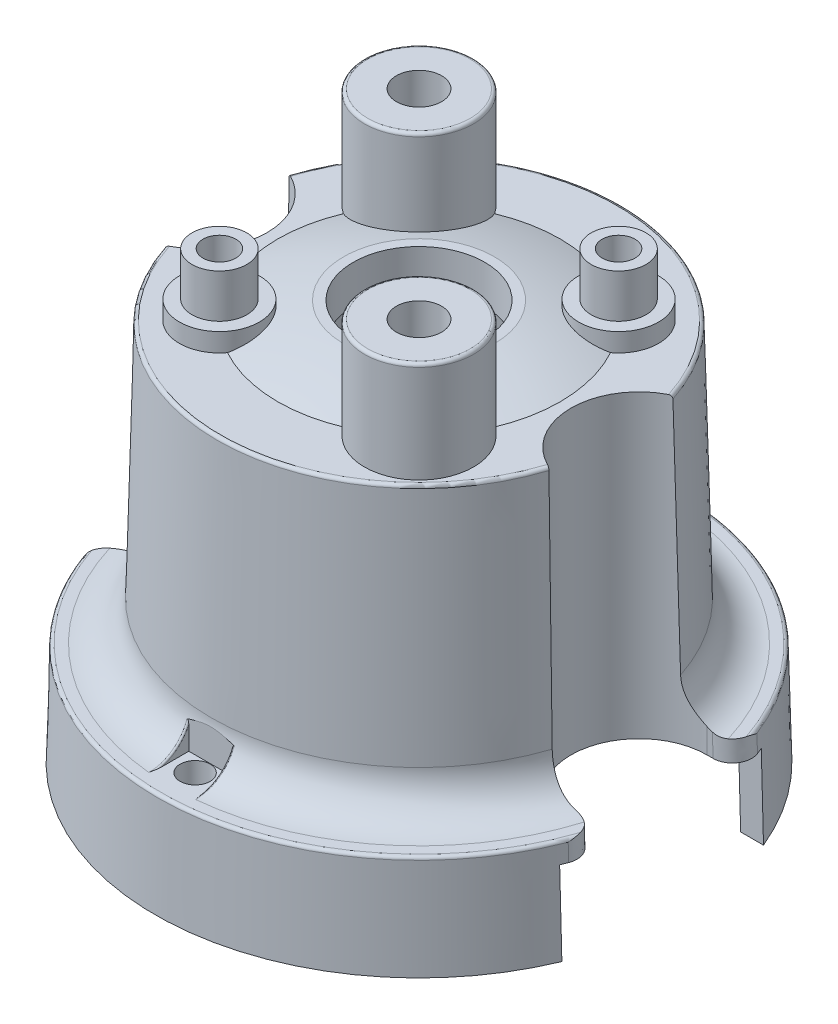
SolidWorks part; units mm, degrees
ref_plane "Front Plane" through (0, 0, 0) normal (0, 0, 1) x (1, 0, 0)
ref_plane "Top Plane" through (0, 0, 0) normal (0, 1, 0) x (1, 0, 0)
ref_plane "Right Plane" through (0, 0, 0) normal (1, 0, 0) x (0, 0, -1)
sketch "Sketch1" plane through (0, 0, 0) normal (0, 0, 1) x (1, 0, 0)
  line L0 (0, 0) -> (0, -78.6325) construction
  line L1 (20.7645, -38.1) -> (0, -38.1)
  line L2 (0, -6.0325) -> (-33.6738, -6.0325) construction
  line L3 (11.1125, -7.9375) -> (15.875, -7.9375)
  line L4 (15.875, -7.9375) -> (16.3447, -26.8757)
  line L5 (0, -38.1) -> (0, -6.0325)
  line L6 (20.5629, -29.972) -> (20.7645, -38.1)
  line L7 (20.5629, -29.972) -> (19.5187, -29.972)
  arc A0 (0, -6.0325) -> (11.1125, -7.9375) centre (0, -39.3965) cw
  arc A1 (19.5187, -29.972) -> (16.3447, -26.8757) centre (19.5187, -26.797) cw
  dimension "D1" = 3.175
  dimension "D2" = 4.1402
  dimension "D3" = 30.1625
  dimension "D4" = 22.225
  dimension "D5" = 31.75
  dimension "D6" = 1.905
  dimension "D7" = 8.128
  dimension "D8" = 41.529
  dimension "D9" = 38.1
revolve "Revolve1" add sketch "Sketch1" angle 360 about L0
sketch "Sketch2" plane through (0, -38.1, 0) normal (0, -1, 0) x (1, 0, 0)
  line L0 (0, 0) -> (17.3212, 0) construction
  line L1 (0, 0) -> (0, 12.9709) construction
  line L2 (-17.3212, 5.3578) -> (-30.4763, 5.3578)
  line L3 (17.3212, 5.3578) -> (30.4763, 5.3578)
  line L4 (17.3212, -5.3578) -> (30.4763, -5.3578)
  line L5 (-17.3212, -5.3578) -> (-30.4763, -5.3578)
  line L6 (-30.4763, 5.3578) -> (-30.4763, -5.3578)
  line L7 (30.4763, 5.3578) -> (30.4763, -5.3578)
  arc A0 (17.3212, 5.3578) -> (17.3212, -5.3578) centre (17.3212, 0) ccw
  arc A1 (-17.3212, 5.3578) -> (-17.3212, -5.3578) centre (-17.3212, 0) cw
  dimension "D1" = 10.7156
  dimension "D2" = 23.9268
  dimension "D3" = 60.9525
extrude "Cut-Extrude1" cut sketch "Sketch2" against normal through all
fillet "Fillet1" radius 0.254 4 edges at (0, -7.9375, 15.875) (0, -7.9375, -15.875) (0, -29.972, -20.5629) (0, -29.972, 20.5629)
shell "Shell1" thickness 1.651
sketch "Sketch3" plane through (0, 0, 0) normal (1, 0, 0) x (0, 0, -1)
  line L2 (14.6942, -26.9166) -> (14.2644, -9.5885) construction
  line L3 (14.8101, -31.5896) -> (14.6942, -26.9166)
  line L5 (18.9515, -31.5896) -> (14.8101, -31.5896)
  arc A0 (14.6942, -26.9166) -> (18.9515, -31.5896) centre (19.5187, -26.797) ccw construction
  arc A1 (14.6942, -26.9166) -> (18.9515, -31.5896) centre (19.5187, -26.797) ccw
revolve "Revolve2" add sketch "Sketch3" angle 360
sketch "Sketch4" plane through (0, -38.1, 0) normal (0, -1, 0) x (1, 0, 0)
  line L0 (-17.3212, 5.3578) -> (-20.0614, 5.3578) construction
  line L1 (-17.3212, -5.3578) -> (-20.0614, -5.3578) construction
  line L2 (17.3212, 5.3578) -> (20.0614, 5.3578) construction
  line L3 (17.3212, -5.3578) -> (20.0614, -5.3578) construction
  line L4 (-17.3212, 5.3578) -> (-20.0614, 5.3578)
  line L5 (-17.3212, -5.3578) -> (-20.0614, -5.3578)
  line L6 (17.3212, 5.3578) -> (20.0614, 5.3578)
  line L7 (17.3212, -5.3578) -> (20.0614, -5.3578)
  line L8 (-20.0614, 5.3578) -> (-20.0614, -5.3578)
  line L9 (20.0614, 5.3578) -> (20.0614, -5.3578)
  arc A0 (-17.3212, -5.3578) -> (-17.3212, 5.3578) centre (-17.3212, 0) ccw construction
  arc A1 (17.3212, 5.3578) -> (17.3212, -5.3578) centre (17.3212, 0) ccw construction
  arc A2 (-17.3212, -5.3578) -> (-17.3212, 5.3578) centre (-17.3212, 0) ccw
  arc A3 (17.3212, 5.3578) -> (17.3212, -5.3578) centre (17.3212, 0) ccw
extrude "Cut-Extrude2" cut sketch "Sketch4" against normal through all
sketch "Sketch5" plane through (0, 0, 0) normal (1, 0, 0) x (0, 0, -1)
  line L0 (-10.8258, -9.5885) -> (0, -9.5885)
  line L1 (0, -26.8757) -> (0, -8.1852) construction
  line L2 (-10.8258, -9.5885) -> (-10.8258, -8.6389)
  line L3 (-10.8258, -8.6389) -> (0, -6.905)
  line L4 (0, -13.2827) -> (0, 5.6104) construction
  line L5 (0, -6.905) -> (0, -9.5885)
  dimension "D1" = 0.9496
  dimension "D2" = 2.6835
revolve "Revolve3" add sketch "Sketch5" angle 360 about axis through (0, -26.8757, 0) along (0, -1, 0)
sketch "Sketch6" plane through (0, -9.5885, 0) normal (0, -1, 0) x (1, 0, 0)
  circle A0 centre (0, 0) radius 5.1816
  dimension "D1" = 10.3632
extrude "Cut-Extrude3" cut sketch "Sketch6" against normal through all
sketch "Sketch7" plane through (0, -9.5885, 0) normal (0, -1, 0) x (1, 0, 0)
  line L0 (0, 0) -> (26.8449, 0) construction
  line L1 (0, 0) -> (21.4445, 21.4445) construction
  line L2 (0, 0) -> (-19.5426, 19.5426) construction
  circle A0 centre (7.8577, 7.8577) radius 4.2926
  circle A1 centre (-7.8577, -7.8577) radius 4.2926
  dimension "D2" = 22.225
  dimension "D3" = 8.5852
  dimension "D1" = 45
extrude "Boss-Extrude1" add sketch "Sketch7" against normal up to surface (9.5885 mm away)
fillet "Fillet2" radius 0.254 2 edges at (7.8577, 0, 12.1503) (-7.8577, 0, -3.5651)
sketch "Sketch8" plane through (0, 0, 0) normal (0, 1, 0) x (1, 0, 0)
  circle A0 centre (-7.8577, 7.8577) radius 1.778
  circle A1 centre (7.8577, -7.8577) radius 1.778
  dimension "D1" = 3.556
extrude "Cut-Extrude4" cut sketch "Sketch8" against normal through all
sketch "Sketch9" plane through (0, -38.1, 0) normal (0, -1, 0) x (1, 0, 0)
  line L0 (0, 0) -> (0, 30.6603) construction
  line L1 (0, 0) -> (43.4145, 0) construction
  circle A0 centre (0, 17.6276) radius 2.8575
  dimension "D1" = 5.715
  dimension "D2" = 35.2552
extrude "Boss-Extrude2" add sketch "Sketch9" against normal up to body
sketch "Sketch10" plane through (0, -38.1, 0) normal (0, -1, 0) x (1, 0, 0)
  circle A0 centre (0, 17.6276) radius 1.1811
  dimension "D1" = 2.3622
extrude "Cut-Extrude5" cut sketch "Sketch10" against normal through all
sketch "Sketch11" plane through (0, -29.972, 0) normal (0, 1, 0) x (1, 0, 0)
  line L0 (0, -17.6276) -> (0, -23.9071) construction
  line L2 (-1.7145, -22.0318) -> (1.7145, -22.0318)
  line L3 (-1.7145, -22.0318) -> (-1.7145, -16.4084)
  line L4 (-1.7145, -16.4084) -> (1.7145, -16.4084)
  line L5 (1.7145, -22.0318) -> (1.7145, -16.4084)
  line L6 (-1.7145, -22.0318) -> (1.7145, -16.4084) construction
  line L7 (-1.7145, -16.4084) -> (1.7145, -22.0318) construction
  circle A0 centre (0, -17.6276) radius 1.1811 construction
  point P4 (0, -19.2201)
  dimension "D1" = 3.429
  dimension "D2" = 1.2192
  dimension "D3" = 5.6234
extrude "Cut-Extrude6" cut sketch "Sketch11" along normal blind 7.62
fillet "Fillet3" radius 0.127 2 edges at (1.7145, -23.9681, 20.89) (-1.7145, -24.3353, 21.4554)
mirror "Mirror1" about plane through (0, 0, 0) normal (0, 0, 1) of "Fillet3", "Boss-Extrude2", "Cut-Extrude5", "Cut-Extrude6"
ref_plane "Plane1" through (0, -6.4373, 0) normal (0, -1, 0) x (-1, 0, 0)
sketch "Sketch12" plane through (0, -6.4373, 0) normal (0, -1, 0) x (-1, 0, 0)
  circle A0 centre (0, 0) radius 5.1816 construction
  circle A1 centre (0, 0) radius 5.1816
  circle A2 centre (0, 0) radius 6.1976
  dimension "D1" = 1.016
extrude "Cut-Extrude7" cut sketch "Sketch12" along normal blind 0.127
sketch "Sketch13" plane through (0, -9.5885, 0) normal (0, -1, 0) x (1, 0, 0)
  line L0 (0, 0) -> (-19.8017, 0) construction
  line L1 (0, 0) -> (-12.0919, 12.0919) construction
  line L2 (0, 0) -> (4.7925, 4.7925) construction
  circle A0 centre (-7.8577, 7.8577) radius 2.159
  circle A1 centre (7.8577, -7.8577) radius 2.159
  dimension "D2" = 22.225
  dimension "D3" = 4.318
  dimension "D1" = 45
extrude "Boss-Extrude3" add sketch "Sketch13" against normal offset from surface (6.5405 mm away) 3.048
sketch "Sketch14" plane through (0, -9.5885, 0) normal (0, -1, 0) x (1, 0, 0)
  line L0 (0, 0) -> (-7.8577, 7.8577) construction
  line L1 (0, 0) -> (5.2539, 5.2539) construction
  circle A0 centre (-7.8577, 7.8577) radius 2.159 construction
  circle A1 centre (-7.8577, 7.8577) radius 2.159 construction
  circle A2 centre (-7.8577, 7.8577) radius 3.1496
  circle A3 centre (7.8577, -7.8577) radius 3.1496
  dimension "D1" = 6.2992
extrude "Boss-Extrude4" add sketch "Sketch14" against normal offset from surface (3.1115 mm away) 3.429
sketch "Sketch15" plane through (0, -9.5885, 0) normal (0, -1, 0) x (1, 0, 0)
  line L0 (-7.8577, 7.8577) -> (0, 0) construction
  line L1 (0, 0) -> (4.5197, 4.5197) construction
  circle A0 centre (-7.8577, 7.8577) radius 2.159 construction
  circle A1 centre (-7.8577, 7.8577) radius 2.159
  circle A2 centre (7.8577, -7.8577) radius 2.159
extrude "Boss-Extrude5" add sketch "Sketch15" along normal blind 2.667
sketch "Sketch16" plane through (0, -12.2555, 0) normal (0, -1, 0) x (1, 0, 0)
  line L0 (-7.8577, 7.8577) -> (0, 0) construction
  line L1 (0, 0) -> (4.3679, 4.3679) construction
  circle A0 centre (-7.8577, 7.8577) radius 1.2954
  circle A1 centre (7.8577, -7.8577) radius 1.2954
  dimension "D1" = 2.5908
extrude "Cut-Extrude8" cut sketch "Sketch16" against normal through all
chamfer "Chamfer1" distance 1.524 angle 45 2 edges at (-6.0797, -9.5885, -7.8577) (9.6357, -9.5885, 7.8577)
sketch "Sketch18" plane through (0, 0, 0) normal (1, 0, 0) x (0, 0, -1)
  line L0 (-14.8036, -31.5896) -> (-5.923, -31.5896) construction
  line L1 (33.108, -31.5896) -> (-34.438, -31.5896) construction
  line L2 (0, 0) -> (0, -54.3531) construction
  line L3 (0, -13.4918) -> (0, 5.3876) construction
  line L4 (0, -26.8757) -> (0, -8.1852) construction
  line L6 (-7.9375, -51.7176) -> (7.9375, -51.7176)
  line L7 (-7.9375, -51.7176) -> (-7.9375, -31.5896)
  line L8 (-7.9375, -31.5896) -> (7.9375, -31.5896)
  line L9 (7.9375, -51.7176) -> (7.9375, -31.5896)
  line L10 (-7.9375, -51.7176) -> (7.9375, -31.5896) construction
  line L11 (-7.9375, -31.5896) -> (7.9375, -51.7176) construction
  point P11 (0, -41.6536)
  dimension "D1" = 15.875
extrude "Cut-Extrude9" cut sketch "Sketch18" against normal through all and the other way through all
fillet "Fillet4" radius 1.524 2 edges
